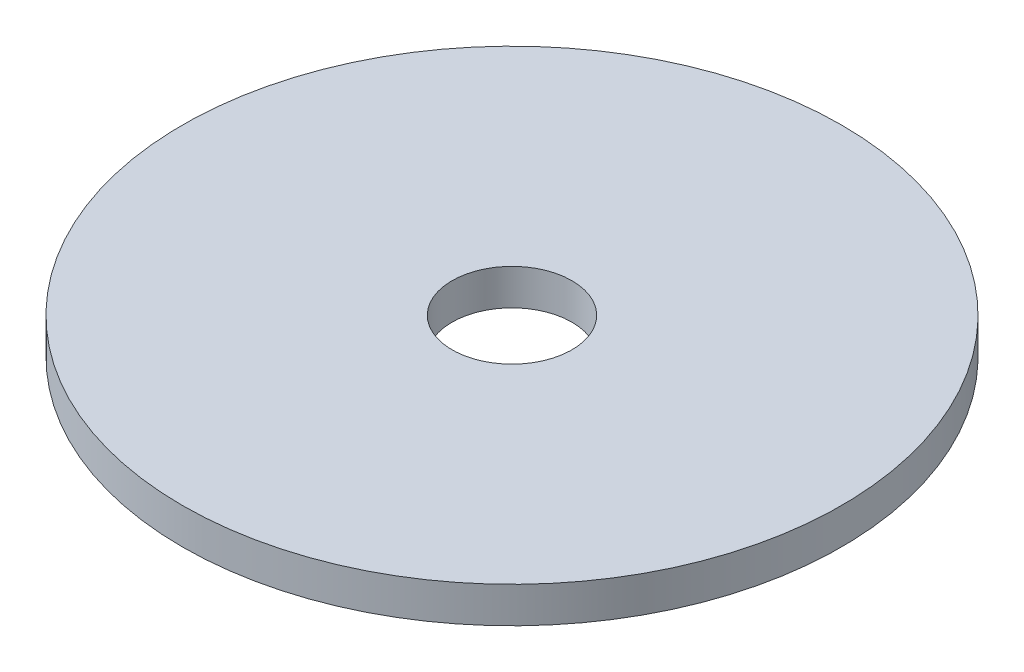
SolidWorks part; units mm, degrees
ref_plane "Front Plane" through (0, 0, 0) normal (0, 0, 1) x (1, 0, 0)
ref_plane "Top Plane" through (0, 0, 0) normal (0, 1, 0) x (1, 0, 0)
ref_plane "Right Plane" through (0, 0, 0) normal (1, 0, 0) x (0, 0, -1)
sketch "Sketch1" plane through (0, 0, 0) normal (0, 1, 0) x (1, 0, 0)
  circle A0 centre (0, 0) radius 27.94
  circle A1 centre (0, 0) radius 5.08
  dimension "D1" = 55.88
  dimension "D2" = 10.16
extrude "Boss-Extrude1" add sketch "Sketch1" along normal blind 3.048 contours A0
